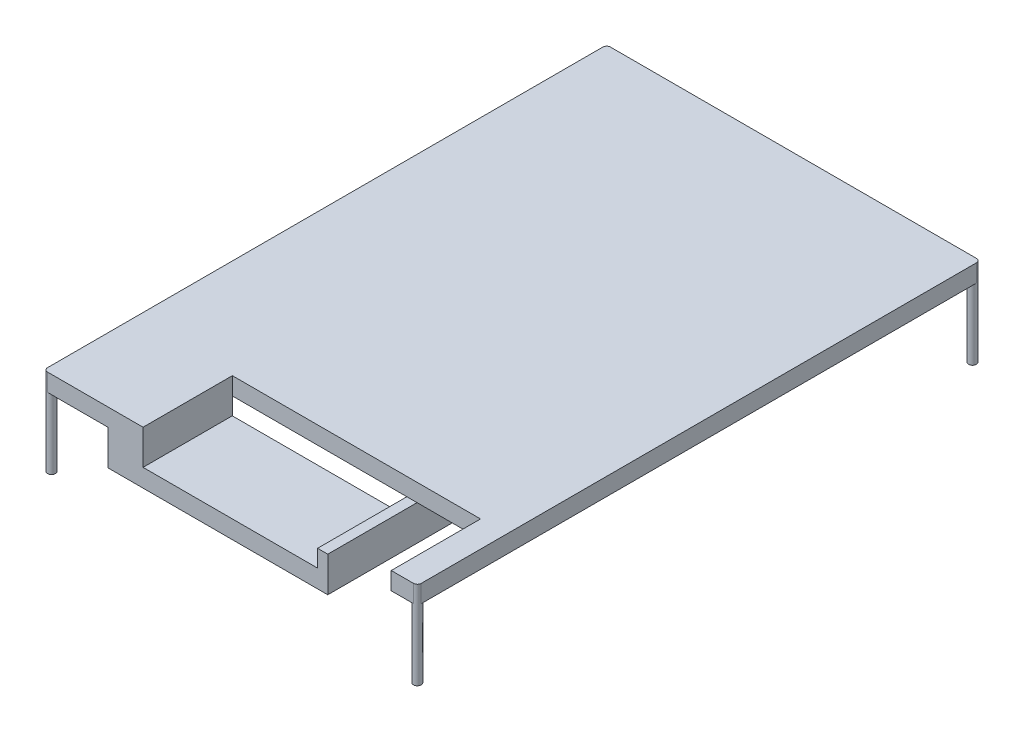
SolidWorks part; units mm, degrees
ref_plane "Front Plane" through (0, 0, 0) normal (0, 0, 1) x (1, 0, 0)
ref_plane "Top Plane" through (0, 0, 0) normal (0, 1, 0) x (1, 0, 0)
ref_plane "Right Plane" through (0, 0, 0) normal (1, 0, 0) x (0, 0, -1)
sketch "Sketch1" plane through (0, 0, 0) normal (0, 1, 0) x (1, 0, 0)
  line L0 (66.04, 0) -> (-66.04, 0) construction
  circle A0 centre (-66.04, 0) radius 1.4
  circle A1 centre (66.04, 0) radius 1.4
  dimension "D1" = 2.8
  dimension "D2" = 132.08
extrude "Boss-Extrude1" add sketch "Sketch1" along normal blind 25.4
sketch "Sketch2" plane through (0, 25.4, 0) normal (0, 1, 0) x (1, 0, 0)
  line L0 (-66.04, 0) -> (-66.04, 1.4) construction
  line L1 (-66.04, 0) -> (-67.44, 0) construction
  line L2 (66.04, 0) -> (66.04, 1.4) construction
  line L3 (66.04, 0) -> (67.44, 0) construction
  line L4 (66.04, 1.4) -> (67.44, 1.4) construction
  line L5 (67.44, 1.4) -> (67.44, 0) construction
  line L6 (-67.44, 0) -> (-67.44, 1.4) construction
  line L7 (-67.44, 1.4) -> (-66.04, 1.4) construction
  line L9 (-66.04, 1.4) -> (66.04, 1.4)
  line L10 (-67.44, 0) -> (-67.44, -201.8)
  line L11 (-67.44, -201.8) -> (67.44, -201.8)
  line L12 (67.44, 0) -> (67.44, -201.8)
  circle A0 centre (-66.04, 0) radius 1.4 construction
  circle A1 centre (66.04, 0) radius 1.4 construction
  arc A2 (-66.04, 1.4) -> (-67.44, 0) centre (-66.04, 0) ccw
  arc A3 (66.04, 1.4) -> (67.44, 0) centre (66.04, 0) cw
  dimension "D2" = 1.4
  dimension "D1" = 203.2
extrude "Boss-Extrude2" add sketch "Sketch2" along normal blind 6.35
sketch "Sketch3" plane through (0, 25.4, 0) normal (0, -1, 0) x (1, 0, 0)
  line L0 (-67.44, 201.8) -> (67.44, 201.8) construction
  line L1 (-67.44, 0) -> (-67.44, 201.8) construction
  line L2 (0, 201.8) -> (0, 191.9924) construction
  circle A0 centre (-66.04, 200.4) radius 1.4
  circle A1 centre (66.04, 200.4) radius 1.4
  dimension "D1" = 2.8
extrude "Boss-Extrude3" add sketch "Sketch3" along normal blind 25.4
sketch "Sketch5" plane through (0, 25.4, 0) normal (0, -1, 0) x (1, 0, 0)
  line L0 (-67.44, 200.4) -> (-67.44, 201.8)
  line L1 (-67.44, 201.8) -> (-66.04, 201.8)
  line L2 (0, 201.8) -> (0, 188.0674) construction
  line L3 (-66.04, 201.8) -> (66.04, 201.8) construction
  line L4 (67.44, 201.8) -> (66.04, 201.8)
  line L5 (67.44, 200.4) -> (67.44, 201.8)
  arc A0 (-67.44, 200.4) -> (-66.04, 201.8) centre (-66.04, 200.4) cw
  arc A1 (-66.04, 201.8) -> (-67.44, 200.4) centre (-66.04, 200.4) ccw construction
  arc A2 (67.44, 200.4) -> (66.04, 201.8) centre (66.04, 200.4) ccw
extrude "Cut-Extrude1" cut sketch "Sketch5" against normal blind 25.4
sketch "Sketch6" plane through (0, 31.75, 0) normal (0, 1, 0) x (1, 0, 0)
  line L0 (67.44, -200.4) -> (67.44, 0) construction
  line L1 (-31.5809, -169.5685) -> (58.0077, -169.5685)
  line L2 (-31.5809, -169.5685) -> (-31.5809, -206.1806)
  line L3 (-31.5809, -206.1806) -> (58.0077, -206.1806)
  line L4 (58.0077, -169.5685) -> (58.0077, -206.1806)
  dimension "D1" = 89.5886
  dimension "D2" = 9.4323
extrude "Cut-Extrude2" cut sketch "Sketch6" against normal through all
sketch "Sketch7" plane through (0, 25.4, 0) normal (0, -1, 0) x (1, 0, 0)
  line L1 (-31.5809, 201.8) -> (-44.2809, 201.8)
  line L2 (-31.5809, 201.8) -> (-31.5809, 169.5914)
  line L3 (-31.5809, 169.5914) -> (-44.2809, 169.5914)
  line L4 (-44.2809, 201.8) -> (-44.2809, 169.5914)
  dimension "D1" = 12.7
extrude "Boss-Extrude4" add sketch "Sketch7" along normal blind 12.7
sketch "Sketch8" plane through (-31.5809, 0, 0) normal (1, 0, 0) x (0, 0, -1)
  line L0 (-201.8, 12.7) -> (-201.8, 31.75) construction
  line L1 (-169.5914, 12.7) -> (-201.8, 12.7)
  line L2 (-169.5914, 12.7) -> (-169.5914, 19.2)
  line L3 (-169.5914, 19.2) -> (-201.8, 19.2)
  line L4 (-201.8, 12.7) -> (-201.8, 19.2)
  dimension "D1" = 6.5
extrude "Boss-Extrude5" add sketch "Sketch8" along normal blind 63
sketch "Sketch9" plane through (0, 25.4, 0) normal (0, -1, 0) x (1, 0, 0)
  line L0 (31.4191, 175.2166) -> (31.4191, 160.3553) construction
  line L1 (31.4191, 201.8) -> (31.4191, 169.5914) construction
  line L2 (27.7207, 201.8) -> (39.9549, 201.8) construction
  line L3 (31.4191, 201.8) -> (-44.2809, 201.8) construction
  line L5 (31.4191, 152.8601) -> (35.1005, 152.8601)
  line L6 (31.4191, 152.8601) -> (31.4191, 201.8)
  line L7 (31.4191, 201.8) -> (35.1005, 201.8)
  line L8 (35.1005, 152.8601) -> (35.1005, 201.8)
extrude "Boss-Extrude6" add sketch "Sketch9" along normal up to vertex
